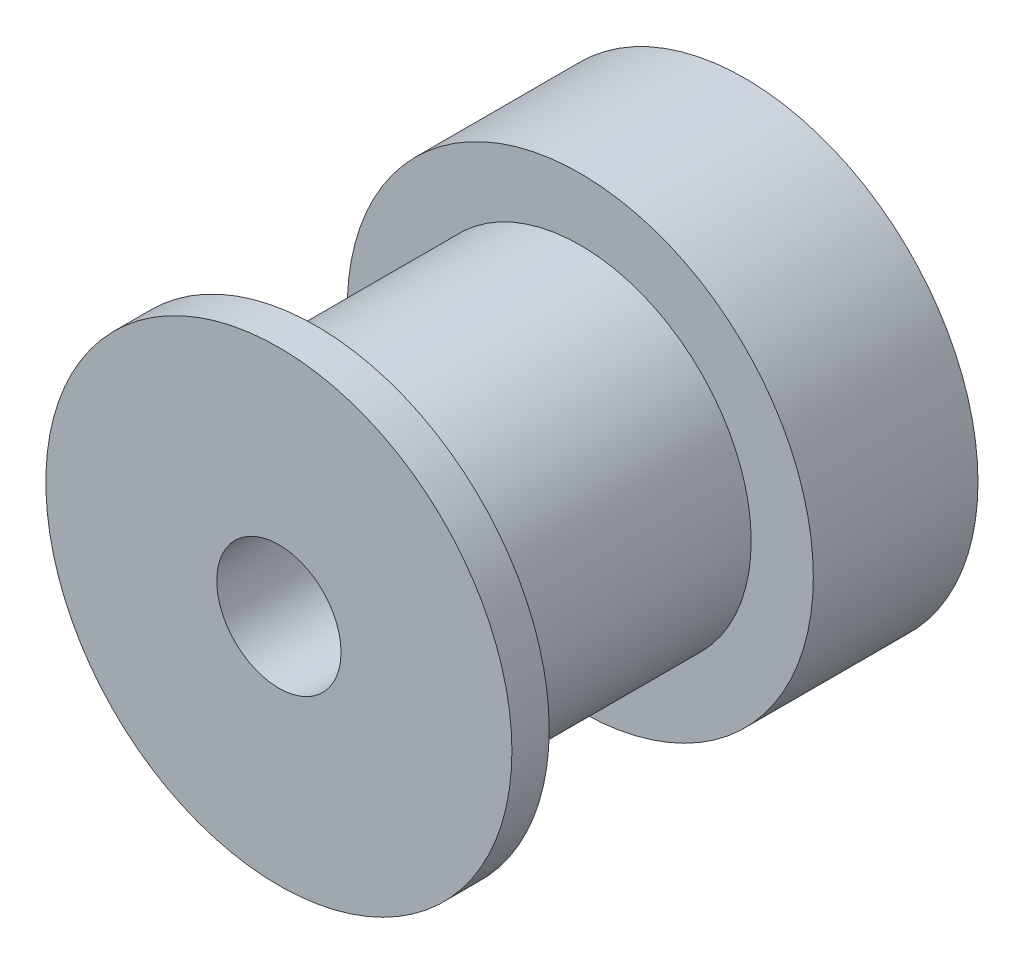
SolidWorks part; units mm, degrees
ref_plane "前视基准面" through (0, 0, 0) normal (0, 0, 1) x (1, 0, 0)
ref_plane "上视基准面" through (0, 0, 0) normal (0, 1, 0) x (1, 0, 0)
ref_plane "右视基准面" through (0, 0, 0) normal (1, 0, 0) x (0, 0, -1)
sketch "草图1" plane through (0, 0, 0) normal (0, 0, 1) x (1, 0, 0)
  circle A0 centre (0, 0) radius 7.5
  dimension "D1" = 15
extrude "凸台-拉伸1" add sketch "草图1" along normal blind 15
sketch "草图2" plane through (0, 0, 15) normal (0, 0, 1) x (1, 0, 0)
  circle A0 centre (0, 0) radius 5.5
  circle A1 centre (0, 0) radius 7.5
  dimension "D1" = 11
extrude "切除-拉伸1" cut sketch "草图2" against normal blind 8.5 from offset 1.2
sketch "草图3" plane through (0, 0, 15) normal (0, 0, 1) x (1, 0, 0)
  circle A0 centre (0, 0) radius 2
  dimension "D1" = 4
extrude "切除-拉伸2" cut sketch "草图3" against normal through all
ref_plane "基准面1" through (0, 0, 9.55) normal (0, 0, -1) x (-1, 0, 0)
